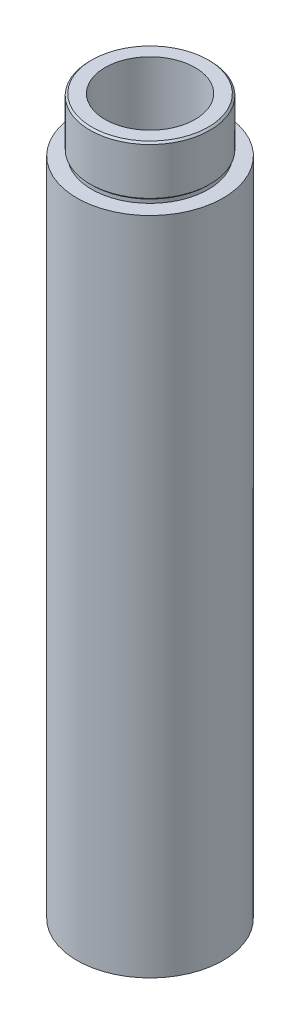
SolidWorks part; units mm, degrees
ref_plane "Plane1" through (0, 0, 0) normal (0, 0, 1) x (1, 0, 0)
ref_plane "Plane2" through (0, 0, 0) normal (0, 1, 0) x (1, 0, 0)
ref_plane "Plane3" through (0, 0, 0) normal (1, 0, 0) x (0, 0, -1)
sketch "Sketch1" plane through (0, 0, 0) normal (0, 0, 1) x (1, 0, 0)
  line L0 (0, 0) -> (0, 95.25) construction
  line L1 (12.7, 0) -> (15.4686, 0)
  line L2 (15.4686, 0) -> (15.4686, 139.7)
  line L3 (15.4686, 139.7) -> (12.319, 139.7)
  line L4 (12.319, 139.7) -> (12.319, 140.4938)
  line L5 (12.319, 140.4938) -> (12.7, 140.8748)
  line L6 (12.7, 140.8748) -> (12.7, 150.749)
  line L7 (12.319, 151.13) -> (12.7, 150.749)
  line L8 (12.319, 151.13) -> (9.525, 151.13)
  line L9 (9.525, 151.13) -> (9.525, 12.7)
  line L10 (9.525, 12.7) -> (12.7, 12.7)
  line L11 (12.7, 12.7) -> (12.7, 11.9063)
  line L12 (12.7, 11.9063) -> (12.319, 11.5253)
  line L13 (12.319, 11.5253) -> (12.319, 0.381)
  line L14 (12.319, 0.381) -> (12.7, 0)
  dimension "D1" = 15.4686
  dimension "D2" = 9.525
  dimension "D3" = 12.7
  dimension "D4" = 0.381
  dimension "D5" = 0.7937
  dimension "D6" = 0.381
  dimension "D8" = 11.43
  dimension "D9" = 0.381
  dimension "D10" = 0.381
  dimension "D11" = 12.7
  dimension "D12" = 12.7
  dimension "D13" = 12.319
  dimension "D14" = 0.381
  dimension "D15" = 0.7937
  dimension "D16" = 0.381
  dimension "D17" = 0.381
  dimension "D18" = 139.7
revolve "Base-Revolve" add sketch "Sketch1" angle 360 about L0
